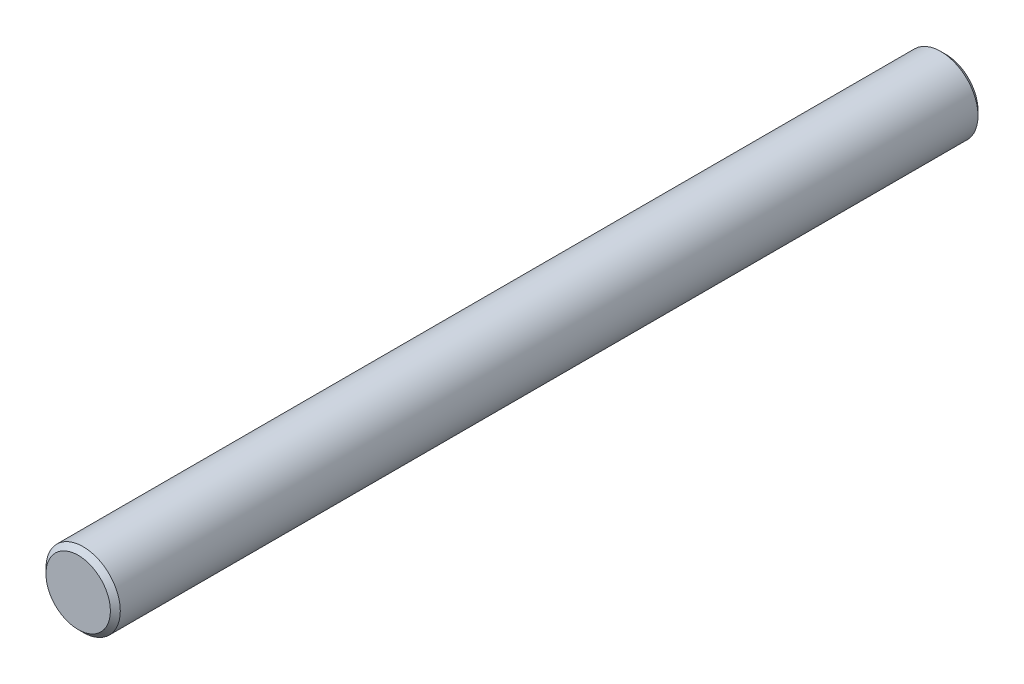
SolidWorks part; units mm, degrees
ref_plane "Plan de face" through (0, 0, 0) normal (0, 0, 1) x (1, 0, 0)
ref_plane "Plan de dessus" through (0, 0, 0) normal (0, 1, 0) x (1, 0, 0)
ref_plane "Plan de droite" through (0, 0, 0) normal (1, 0, 0) x (0, 0, -1)
sketch "Esquisse1" plane through (0, 0, 0) normal (0, 0, 1) x (1, 0, 0)
  circle A1 centre (0, 0) radius 1.5
extrude "Boss.-Extru.1" add sketch "Esquisse1" along normal blind 35
chamfer "Chanfrein1" distance 0.2 angle 45 2 edges at (1.5, 0, 35) (1.5, 0, 0)
